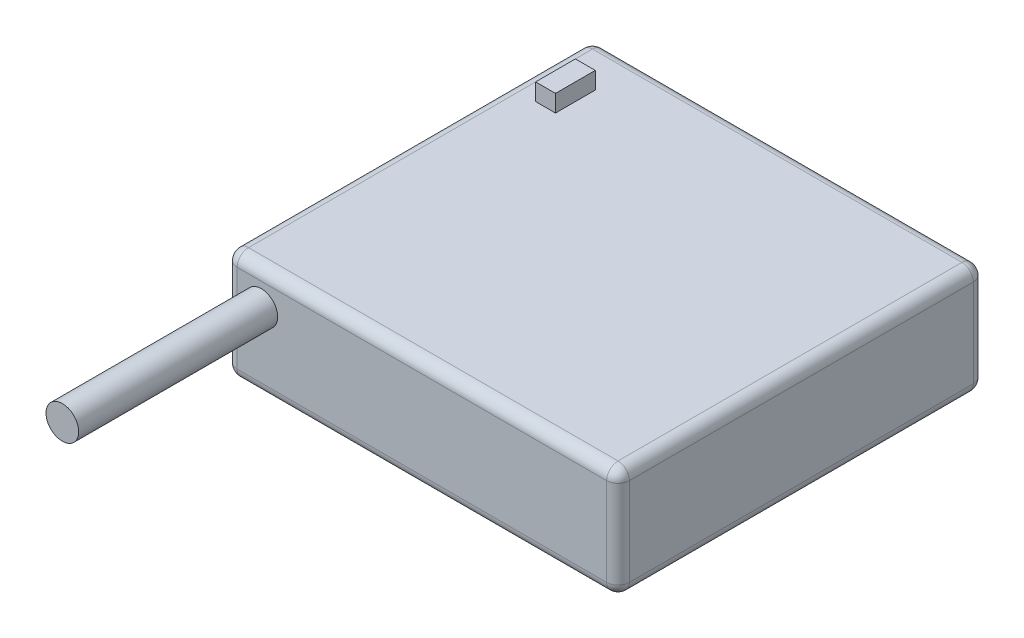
SolidWorks part; units mm, degrees
ref_plane "Front Plane" through (0, 0, 0) normal (0, 0, 1) x (1, 0, 0)
ref_plane "Top Plane" through (0, 0, 0) normal (0, 1, 0) x (1, 0, 0)
ref_plane "Right Plane" through (0, 0, 0) normal (1, 0, 0) x (0, 0, -1)
sketch "Sketch1" plane through (0, 0, 0) normal (1, 0, 0) x (0, 0, -1)
  line L1 (0, 0) -> (64.5, 0)
  line L2 (0, 0) -> (0, 19.5)
  line L3 (0, 19.5) -> (64.5, 19.5)
  line L4 (64.5, 0) -> (64.5, 19.5)
  dimension "D1" = 19.5
  dimension "D2" = 64.5
extrude "Boss-Extrude1" add sketch "Sketch1" along normal blind 69
fillet "Fillet1" radius 2 4 edges at (34.5, 0, 0) (34.5, 19.5, 0) (34.5, 0, -64.5) (34.5, 19.5, -64.5)
fillet "Fillet2" radius 2 16 edges at (69, 18.9142, -63.9142) (69, 9.75, -64.5) (69, 0.5858, -63.9142) (69, 0, -32.25) (69, 0.5858, -0.5858) (69, 9.75, 0) (69, 18.9142, -0.5858) (0, 18.9142, -63.9142) (0, 9.75, -64.5) (0, 0.5858, -63.9142) (0, 0, -32.25) (0, 0.5858, -0.5858) (0, 9.75, 0) (0, 18.9142, -0.5858) (69, 19.5, -32.25) (0, 19.5, -32.25)
sketch "Sketch2" plane through (0, 0, 0) normal (0, 0, 1) x (1, 0, 0)
  line L2 (2, 19.5) -> (67, 19.5) construction
  line L3 (0, 2) -> (0, 17.5) construction
  circle A0 centre (6.25, 13.5) radius 2.875
  dimension "D2" = 5.75
  dimension "D1" = 6
  dimension "D3" = 6.25
extrude "Boss-Extrude2" add sketch "Sketch2" along normal blind 35
sketch "Sketch3" plane through (0, 19.5, 0) normal (0, 1, 0) x (1, 0, 0)
  line L1 (0, 2) -> (0, 62.5) construction
  line L7 (5, 56.5) -> (8.5, 56.5)
  line L8 (5, 56.5) -> (5, 49.5)
  line L9 (5, 49.5) -> (8.5, 49.5)
  line L10 (8.5, 56.5) -> (8.5, 49.5)
  line L11 (2, 64.5) -> (67, 64.5) construction
  dimension "D1" = 5
  dimension "D6" = 3.5
  dimension "D7" = 15
  dimension "D8" = 7
extrude "Boss-Extrude3" add sketch "Sketch3" along normal blind 3
